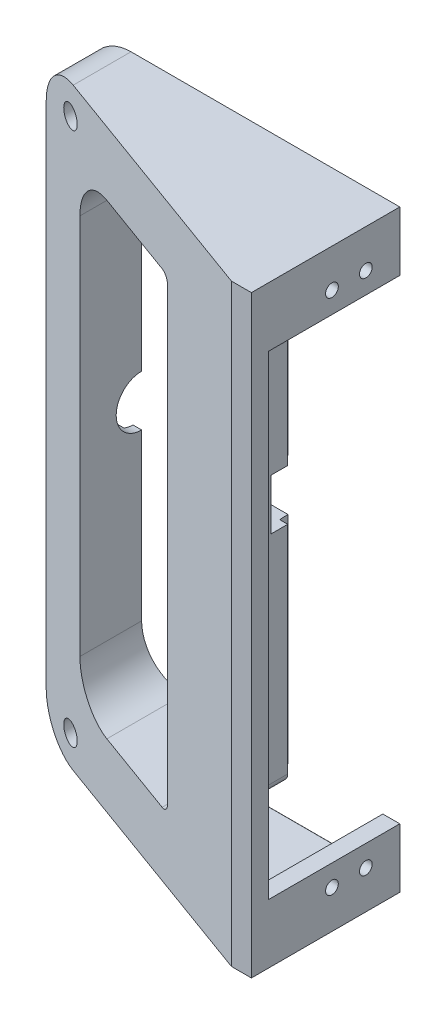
SolidWorks part; units mm, degrees
ref_plane "Front Plane" through (0, 0, 0) normal (0, 0, 1) x (1, 0, 0)
ref_plane "Top Plane" through (0, 0, 0) normal (0, 1, 0) x (1, 0, 0)
ref_plane "Right Plane" through (0, 0, 0) normal (1, 0, 0) x (0, 0, -1)
body saved out of another part "Stock-Top2-1"
other "Lip&Groove3-Groove" parameters "GrooveHeight"=2.032, "GrooveWidth"=2, "GrooveDraftAngle"=3, "Clearance"=0, "Gap"=0, "upGap"=2.032, "D7"=2, "D8"=3, "D9"=0
fillet "Fillet7" radius 2 6 edges at (-33.1078, 66, 16.516) (-33.1078, -66, 16.516) (-53.5, -59, 12.8049) (-53.5, 59, 12.8049) (-57.5, -55, 13.1893) (-57.5, 55, 13.1893)
fillet "Fillet12" radius 2 3 edges at (-57.5, -10, 6) (-57.5, 10, 6) (-57.5, 0, 10)
